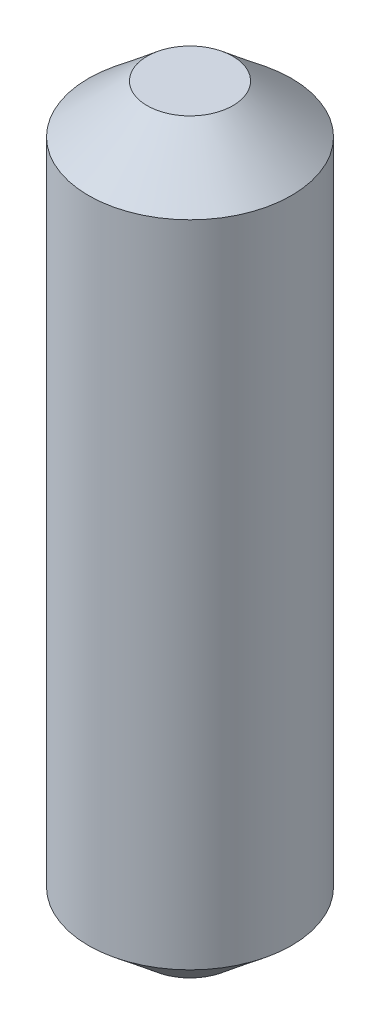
SolidWorks part; units mm, degrees
ref_plane "front" through (0, 0, 0) normal (0, 0, 1) x (1, 0, 0)
ref_plane "top" through (0, 0, 0) normal (0, 1, 0) x (1, 0, 0)
ref_plane "side" through (0, 0, 0) normal (1, 0, 0) x (0, 0, -1)
sketch "Sketch1" plane through (0, 0, 0) normal (0, 0, 1) x (1, 0, 0)
  line L0 (0, 0) -> (0.4826, 0)
  line L2 (1.143, 0.5461) -> (1.143, 7.8613)
  line L3 (1.143, 7.8613) -> (0.4826, 8.4074)
  line L4 (0.4826, 8.4074) -> (0, 8.4074)
  line L5 (0, -50) -> (0, 50) construction
  line L6 (0, 8.4074) -> (0, 0)
  line L7 (0, 0) -> (0, 59.3658) construction
  line L8 (0, 4.2037) -> (-19.8416, 4.2037) construction
  line L9 (1.143, 0.5461) -> (0.4826, 0)
  dimension "D1" = 0.9652
  dimension "D2" = 2.286
  dimension "D3" = 8.4074
  dimension "D4" = 7.3152
revolve "Revolve1" add sketch "Sketch1" angle 360 about L7
